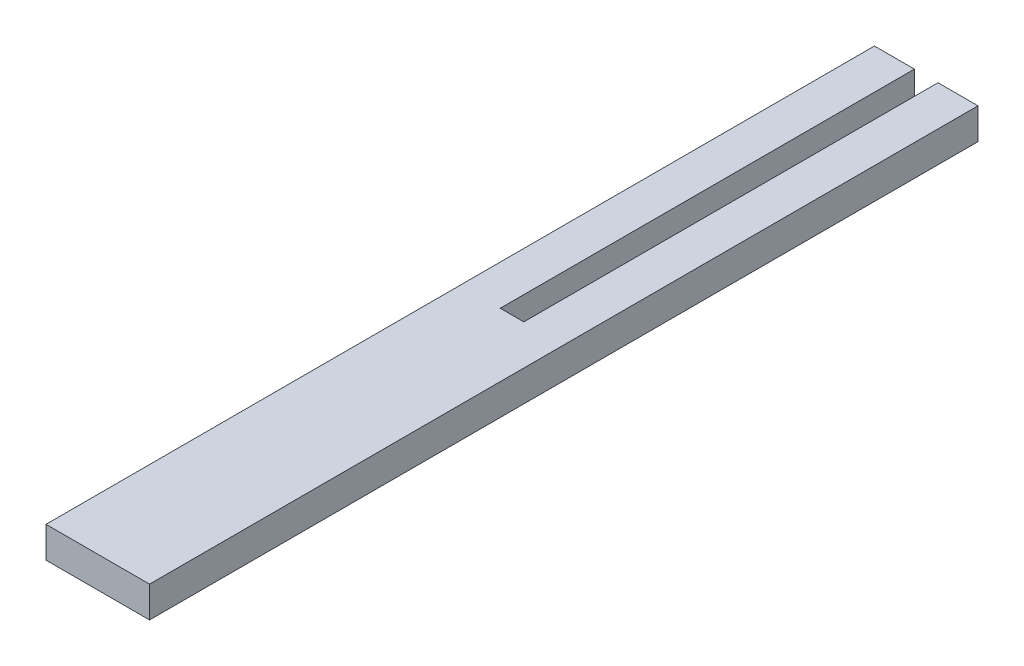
SolidWorks part; units mm, degrees
ref_plane "Alzado" through (0, 0, 0) normal (0, 0, 1) x (1, 0, 0)
ref_plane "Planta" through (0, 0, 0) normal (0, 1, 0) x (1, 0, 0)
ref_plane "Vista lateral" through (0, 0, 0) normal (1, 0, 0) x (0, 0, -1)
sketch "Sketch1" plane through (0, 0, 0) normal (0, 1, 0) x (1, 0, 0)
  line L0 (0, -40) -> (0, 40) construction
  line L1 (-5, 40) -> (5, 40)
  line L2 (-5, 40) -> (-5, -40)
  line L3 (-5, -40) -> (5, -40)
  line L4 (5, 40) -> (5, -40)
  line L5 (-5, 40) -> (5, -40) construction
  line L6 (-5, -40) -> (5, 40) construction
  line L7 (-5, 0) -> (5, 0) construction
  line L12 (-1.19, 40) -> (1.09, 40)
  line L14 (-1.19, 40) -> (-1.19, 0)
  line L15 (-1.19, 0) -> (1.09, 0)
  line L16 (1.09, 0) -> (1.09, 40)
  line L17 (1.09, 40) -> (-1.19, 40)
  point P0 (0, 0)
extrude "Boss-Extrude1" add sketch "Sketch1" against normal blind 3 contours L4 L3 L2 L1
sketch "Sketch2" plane through (0, 0, 0) normal (0, 1, 0) x (1, 0, 0)
  line L0 (-5, 0) -> (5, 0) construction
  line L1 (-5, 40) -> (-5, -40) construction
  line L2 (5, 40) -> (5, -40) construction
  line L3 (0, -40) -> (0, 40) construction
  line L4 (-5, -40) -> (5, -40) construction
  line L5 (-5, 40) -> (5, 40) construction
  line L7 (-1.14, 80) -> (1.14, 80)
  line L8 (-1.14, 80) -> (-1.14, 0)
  line L9 (-1.14, 0) -> (1.14, 0)
  line L10 (1.14, 80) -> (1.14, 0)
  line L11 (-1.14, 80) -> (1.14, 0) construction
  line L12 (-1.14, 0) -> (1.14, 80) construction
extrude "Cut-Extrude2" cut sketch "Sketch2" against normal blind 3
equation "\"an\"= 10mm"
equation "\"D1@Sketch1\"=\"an\""
equation "\"la\" = 80mm"
equation "\"D2@Sketch1\"=\"la\""
equation "\"aanrect\" = 2.28mm"
equation "\"D3@Sketch1\"=\"aanrect\""
equation "\"lam\"= \"la\" / 2mm"
equation "\"D4@Sketch1\"=\"lam\""
equation "\"D2@Sketch2\"=\"la\""
equation "\"D1@Sketch2\"=\"aanrect\""
